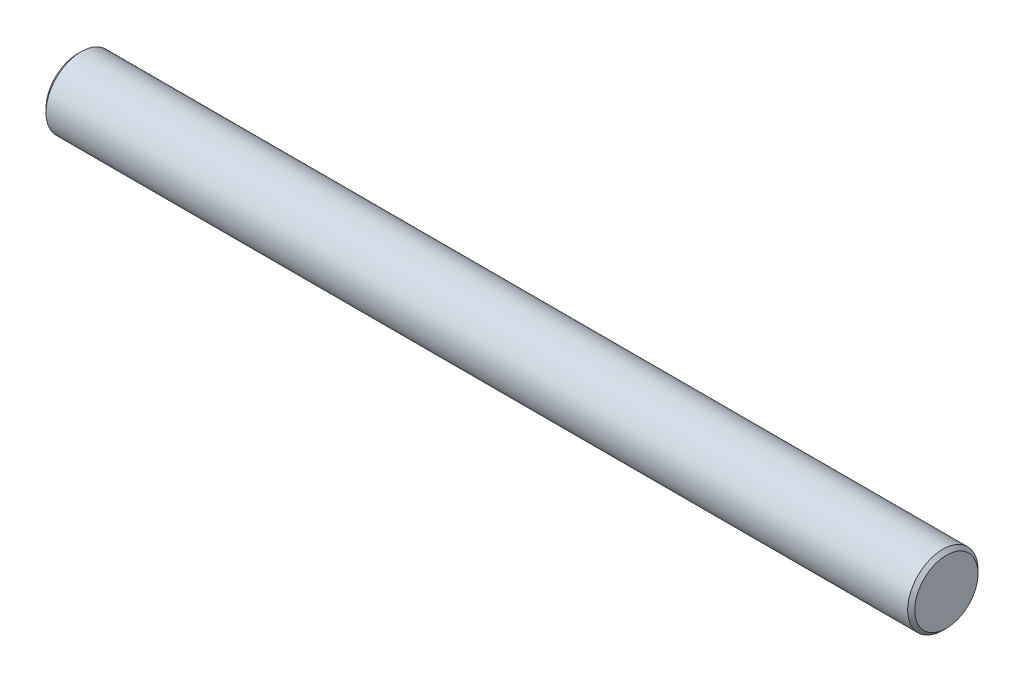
SolidWorks part; units mm, degrees
ref_plane "Front" through (0, 0, 0) normal (0, 0, 1) x (1, 0, 0)
ref_plane "Top" through (0, 0, 0) normal (0, 1, 0) x (1, 0, 0)
ref_plane "Right" through (0, 0, 0) normal (1, 0, 0) x (0, 0, -1)
sketch "Sketch1" plane through (0, 0, 0) normal (1, 0, 0) x (0, 0, -1)
  circle A0 centre (0, 0) radius 10
  dimension "D1" = 20
extrude "Extrude1" add sketch "Sketch1" along normal blind 247
chamfer "Chamfer1" distance 1 angle 45 2 edges at (0, 0, -10) (247, 0, -10)
